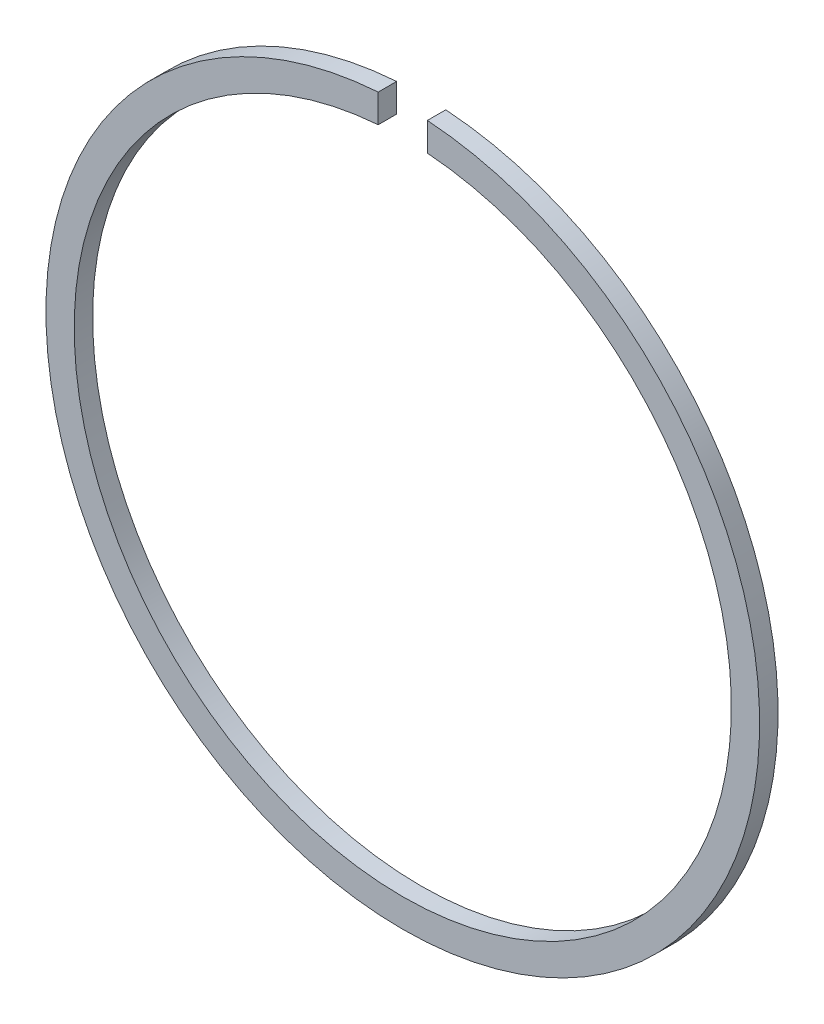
SolidWorks part; units mm, degrees
ref_plane "Plan de face" through (0, 0, 0) normal (0, 0, 1) x (1, 0, 0)
ref_plane "Plan de dessus" through (0, 0, 0) normal (0, 1, 0) x (1, 0, 0)
ref_plane "Plan de droite" through (0, 0, 0) normal (1, 0, 0) x (0, 0, -1)
sketch "Esquisse1" plane through (0, 0, 0) normal (0, 0, 1) x (1, 0, 0)
  circle A0 centre (0, 0) radius 29.05
  circle A1 centre (0, 0) radius 26.75
  dimension "D1" = 53.5
  dimension "D2" = 58.1
extrude "Extrusion1" add sketch "Esquisse1" along normal mid plane 1.5
sketch "Esquisse3" plane through (0, 0, 0.75) normal (0, 0, 1) x (1, 0, 0)
  line L0 (-2, 26.6751) -> (-2, 28.9811)
  line L1 (2, 26.6751) -> (2, 28.9811)
  circle A0 centre (0, 0) radius 26.75 construction
  arc A1 (2, 26.6751) -> (-2, 26.6751) centre (0, 0) ccw
  circle A2 centre (0, 0) radius 29.05 construction
  arc A3 (2, 28.9811) -> (-2, 28.9811) centre (0, 0) ccw
  dimension "D1" = 2
  dimension "D2" = 4
extrude "Enlèv. mat.-Extru.1" cut sketch "Esquisse3" against normal through all
